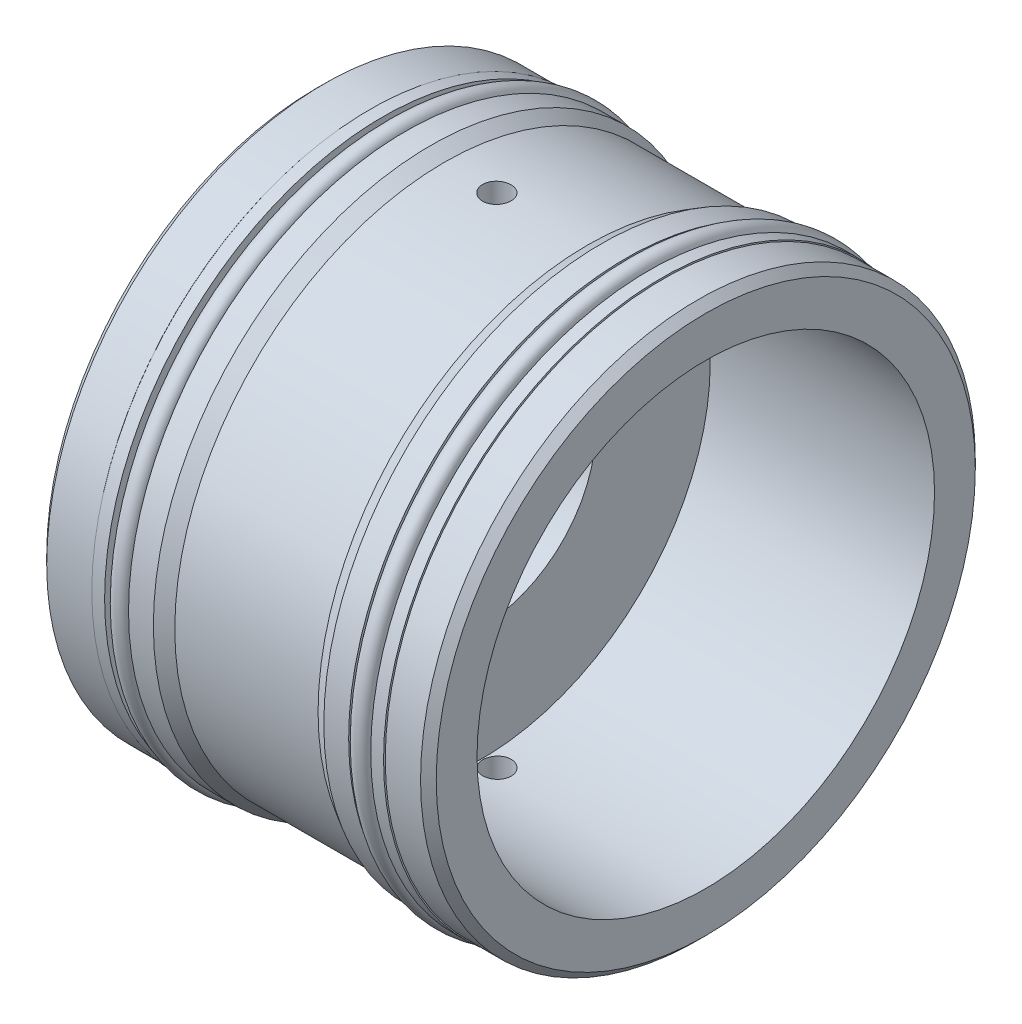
SolidWorks part; units mm, degrees
ref_plane "Front Plane" through (0, 0, 0) normal (0, 0, 1) x (1, 0, 0)
ref_plane "Top Plane" through (0, 0, 0) normal (0, 1, 0) x (1, 0, 0)
ref_plane "Right Plane" through (0, 0, 0) normal (1, 0, 0) x (0, 0, -1)
sketch "Sketch1" plane through (0, 0, 0) normal (0, 0, 1) x (1, 0, 0)
  line L0 (0, 0) -> (0, 45.5562) construction
  line L1 (0, 0) -> (32.8567, 0) construction
  line L2 (-18.923, 11.1125) -> (-18.923, 26.9494)
  line L3 (-18.923, 26.9494) -> (-13.7668, 26.9494)
  line L4 (-13.7668, 26.9494) -> (-13.7668, 25.6921)
  line L5 (-13.7668, 25.6921) -> (-10.2108, 25.6921)
  line L6 (-10.2108, 25.6921) -> (-10.2108, 26.9494)
  line L7 (-10.2108, 26.9494) -> (-7.7978, 26.9494)
  line L8 (-7.7978, 26.9494) -> (-7.7978, 26.1874)
  line L9 (-7.7978, 26.1874) -> (8.763, 26.1874)
  line L10 (-18.923, 11.1125) -> (-2.8702, 11.1125)
  line L11 (-2.8702, 11.1125) -> (-2.8702, 22.225)
  line L12 (-2.8702, 22.225) -> (18.923, 22.225)
  line L13 (8.763, 26.9494) -> (8.763, 26.1874)
  line L14 (11.176, 26.9494) -> (8.763, 26.9494)
  line L15 (11.176, 25.6921) -> (11.176, 26.9494)
  line L16 (14.732, 25.6921) -> (11.176, 25.6921)
  line L17 (14.732, 26.9494) -> (14.732, 25.6921)
  line L18 (18.923, 26.9494) -> (14.732, 26.9494)
  line L19 (18.923, 26.9494) -> (18.923, 22.225)
  dimension "D2" = 3.556
  dimension "D3" = 16.5608
  dimension "D4" = 53.8988
  dimension "D5" = 37.846
  dimension "D6" = 44.45
  dimension "D7" = 21.7932
  dimension "D8" = 52.3748
  dimension "D9" = 51.3842
  dimension "D10" = 22.225
  dimension "D11" = 32.6898
  dimension "D12" = 2.413
  dimension "D13" = 2.413
revolve "Revolve1" add sketch "Sketch1" angle 360 about L1
chamfer "Chamfer1" distance 0.762 angle 45 2 edges at (18.923, 0, 26.9494) (-18.923, 0, 26.9494)
sketch "Sketch6" plane through (0, 0, 0) normal (0, 0, 1) x (1, 0, 0)
  line L0 (0, 0) -> (49.5791, 0) construction
  line L1 (-18.923, 26.1874) -> (-18.923, -26.1874) construction
  line L2 (-10.2108, 25.6921) -> (-13.7668, 25.6921) construction
  line L3 (-13.6906, 25.6921) -> (-12.446, 25.6921)
  line L4 (-13.6906, 25.6921) -> (-13.6906, 27.0383)
  line L5 (-13.6906, 27.0383) -> (-12.446, 27.0383)
  line L6 (-12.446, 25.6921) -> (-12.446, 27.0383)
  line L7 (0.4826, 41.4439) -> (0.4826, -9.3524) construction
  line L8 (-13.7668, -26.9494) -> (-13.7668, 26.9494) construction
  line L9 (14.732, 25.6921) -> (14.732, -25.6921) construction
  line L10 (-10.2108, 26.9494) -> (-10.2108, -26.9494) construction
  line L11 (13.4112, 25.6921) -> (13.4112, 27.0383)
  line L12 (14.6558, 27.0383) -> (13.4112, 27.0383)
  line L13 (14.6558, 25.6921) -> (14.6558, 27.0383)
  line L14 (14.6558, 25.6921) -> (13.4112, 25.6921)
  circle A0 centre (-11.176, 26.5049) radius 0.889
  circle A1 centre (12.1412, 26.5049) radius 0.889
  dimension "D4" = 1.778
  dimension "D5" = 53.0098
  dimension "D6" = 0.9652
  dimension "D1" = 1.2446
  dimension "D2" = 5.2324
  dimension "D3" = 54.0766
revolve "Revolve3" add sketch "Sketch6" angle 360 about L0
sketch "Sketch7" plane through (0, 0, 0) normal (0, 1, 0) x (0, 0, -1)
  line L1 (-26.1874, -18.923) -> (26.1874, -18.923) construction
  circle A0 centre (0, 1.3716) radius 1.3843
  dimension "D1" = 2.7686
  dimension "D2" = 20.2946
extrude "Cut-Extrude1" cut sketch "Sketch7" against normal through all and the other way through all
sketch "Sketch8" plane through (0, 0, 0) normal (0, 0, 1) x (1, 0, 0)
  line L0 (-7.7978, 26.9494) -> (-7.7978, 26.1874)
  line L1 (-7.7978, -26.9494) -> (-7.7978, 26.9494) construction
  line L2 (-2.7559, 26.1874) -> (-7.7978, 26.1874) construction
  line L3 (-7.7978, 26.1874) -> (-6.478, 26.1874)
  line L4 (-6.478, 26.1874) -> (-7.7978, 26.9494)
  line L5 (0, 0) -> (23.2012, 0) construction
  line L6 (0.4826, 31.5075) -> (0.4826, -4.3873) construction
  line L7 (8.763, 26.1874) -> (8.763, -26.1874) construction
  line L8 (7.4432, 26.1874) -> (8.763, 26.9494)
  line L9 (8.763, 26.1874) -> (7.4432, 26.1874)
  line L10 (8.763, 26.9494) -> (8.763, 26.1874)
  line L11 (11.176, 26.9494) -> (8.763, 26.9494) construction
  dimension "D1" = 30
revolve "Revolve4" add sketch "Sketch8" angle 360 about L5
